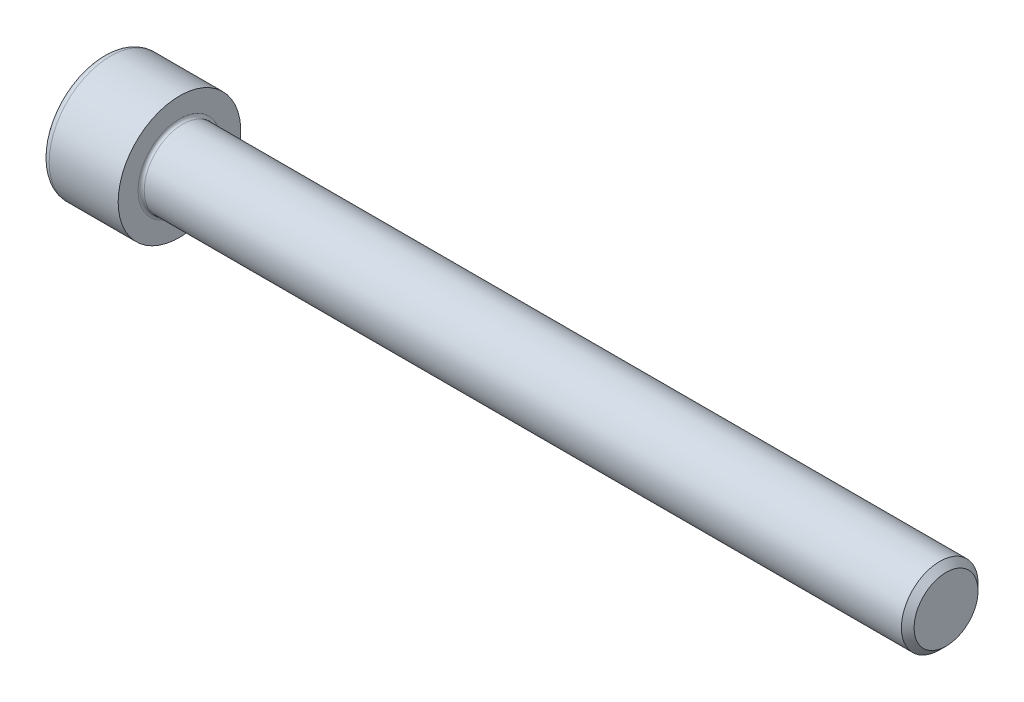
SolidWorks part; units mm, degrees
ref_plane "Plane1" through (0, 0, 0) normal (0, 0, 1) x (1, 0, 0)
ref_plane "Plane2" through (0, 0, 0) normal (0, 1, 0) x (1, 0, 0)
ref_plane "Plane3" through (0, 0, 0) normal (1, 0, 0) x (0, 0, -1)
sketch "BodySke" plane through (0, 0, 0) normal (0, 0, 1) x (1, 0, 0)
  line L0 (0, 0) -> (0, 8)
  line L1 (0, 8) -> (10, 8)
  line L2 (10, 8) -> (10, 5)
  line L3 (10, 5) -> (109.172, 5)
  line L4 (110, 4.172) -> (110, 0)
  line L5 (110, 0) -> (0, 0)
  line L6 (-31.75, 0) -> (127, 0) construction
  line L8 (110, 4.172) -> (109.172, 5)
  line L10 (110, -4.172) -> (109.172, -5) construction
  line L11 (11.5, 9.525) -> (11.5, 3.175) construction
  line L12 (10, 9.525) -> (10, 3.175) construction
  line L13 (50, 9.525) -> (50, 3.175) construction
  dimension "Diameter" = 10
  dimension "Head_ht" = 10
  dimension "Length" = 100
  dimension "Body_ch_ang" = 45
  dimension "Head_dia" = 16
  dimension "Minor_dia" = 8.344
  dimension "Advance" = 1.5
  dimension "Thread_nom" = 100
  dimension "Thread_length" = 60
revolve "Base-Revolve" add sketch "BodySke"
fillet "Fillet1" radius 0.4 1 edges at (10, 0, 5)
fillet "Fillet2" radius 1 1 edges at (0, 0, 8)
sketch "Sketch2" plane through (0, 0, 0) normal (0, 0, 1) x (1, 0, 0)
  line L0 (0, 4.0125) -> (5, 4.0125)
  line L1 (5, 4.0125) -> (7.3166, 0)
  line L2 (-31.75, 0) -> (127, 0) construction
  line L3 (7.3166, 0) -> (0, 0)
  line L4 (0, 0) -> (0, 4.0125)
  line L6 (0, 0) -> (47.625, 0) construction
  dimension "D1" = 4.0125
  dimension "D2" = 60
  dimension "Depth" = 5
revolve "Hex-PreBroach" cut sketch "Sketch2" angle 360 about L6
sketch "Sketch3" plane through (0, 0, 0) normal (-1, 0, 0) x (0, 0.5, 0.866)
  line L0 (2.3166, 4.0125) -> (-2.3166, 4.0125)
  line L1 (-2.3166, 4.0125) -> (-4.6332, 0)
  line L2 (2.3166, 4.0125) -> (4.6332, 0)
  line L3 (2.3166, -4.0125) -> (4.6332, 0)
  line L4 (2.3166, -4.0125) -> (-2.3166, -4.0125)
  line L5 (-2.3166, -4.0125) -> (-4.6332, 0)
  dimension "D1" = 4.0125
  dimension "D2" = 4.0125
  dimension "Hex_size" = 8.025
extrude "Hex" cut sketch "Sketch3" against normal blind 5
sketch "ThdSchSke" plane through (0, 0, 0) normal (0, 0, 1) x (1, 0, 0)
  line L0 (14.5, -4.172) -> (13.9202, -5)
  line L1 (14.5, -4.172) -> (15.0798, -5)
  line L2 (15.0798, -5) -> (15.0798, -6.25)
  line L3 (-3.175, 0) -> (5.1513, 0) construction
  line L4 (0, 7) -> (0, -7) construction
  line L5 (15.0798, -6.25) -> (13.9202, -6.25)
  line L6 (13.9202, -6.25) -> (13.9202, -5)
  dimension "Thread_minor" = 8.344
  dimension "Diameter" = 10
  dimension "Start" = 14.5
  dimension "SideAngle" = 55
  dimension "VeeAngle" = 70
  dimension "Overcut" = 12.5
revolve "ThreadSchematic" [suppressed] cut sketch "ThdSchSke" angle 360 about L3
pattern_linear "ThdSchPat" [suppressed]
equation "\"D2@Sketch3\" = \"Hex_size@Sketch3\" / 2"
equation "\"D1@Sketch3\" = \"Hex_size@Sketch3\" / 2"
equation "\"D1@Sketch2\" = \"Hex_size@Sketch3\" / 2"
equation "\"Thread_minor@ThreadCosmetic\"  =  \"Minor_dia@BodySke\""
equation "\"Depth@Sketch2\" =  \"Key_eng@Hex\""
equation "\"Thread_length@ThreadCosmetic\" = ((sgn( (\"Length@BodySke\" - \"Advance@BodySke\" * 3.0) - \"Thread_nom@BodySke\" )-1)*( (\"Length@BodySke\" - \"Advance@BodySke\" * 3.0) - \"Thread_nom@BodySke\" ))/-2+ \"Thread_no"
equation "\"Thread_minor@ThdSchSke\" = \"Minor_dia@BodySke\""
equation "\"Diameter@ThdSchSke\" = \"Diameter@BodySke\""
equation "\"Overcut@ThdSchSke\" = \"Diameter@BodySke\" * 1.25"
equation "\"Start@ThdSchSke\" = \"Head_ht@BodySke\" + \"Length@BodySke\" - \"Thread_length@ThreadCosmetic\"  '---Non-countersunk---"
equation "\"Num_threads@ThdSchPat\" = int( \"Thread_length@ThreadCosmetic\" / \"Advance@BodySke\" + 0.999 )  + 1"
equation "\"Advance@ThdSchPat\" = \"Thread_length@ThreadCosmetic\" /  (\"Num_threads@ThdSchPat\" - 1) 'relax it"
equation "\"Num_threads@ThdSchPat\" = \"Num_threads@ThdSchPat\" - sgn( \"Num_threads@ThdSchPat\" - 1) '---chamfered tips only---"
